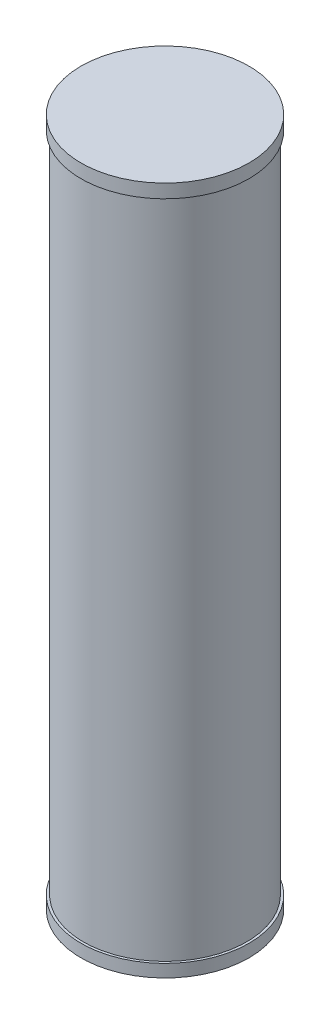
SolidWorks part; units mm, degrees
ref_plane "Front Plane" through (0, 0, 0) normal (0, 0, 1) x (1, 0, 0)
ref_plane "Top Plane" through (0, 0, 0) normal (0, 1, 0) x (1, 0, 0)
ref_plane "Right Plane" through (0, 0, 0) normal (1, 0, 0) x (0, 0, -1)
sketch "Sketch1" plane through (0, 0, 0) normal (0, 0, 1) x (1, 0, 0)
  line L0 (0, -15.9947) -> (0, -74.8129) construction
  line L1 (-109.5375, 880.11) -> (0, 880.11)
  line L2 (-106.4387, 862.33) -> (-106.4387, -1.27)
  line L3 (-109.5375, -17.78) -> (0, -17.78)
  line L4 (0, 880.11) -> (0, -17.78)
  line L7 (-106.4387, 862.33) -> (-109.5375, 862.33)
  line L8 (-109.5375, 862.33) -> (-109.5375, 880.11)
  line L10 (-106.4387, -1.27) -> (-109.5375, -1.27)
  line L11 (-109.5375, -1.27) -> (-109.5375, -17.78)
  point P26 (-106.4387, 560.9667)
revolve "Revolve1" add sketch "Sketch1" angle 360 about L0
